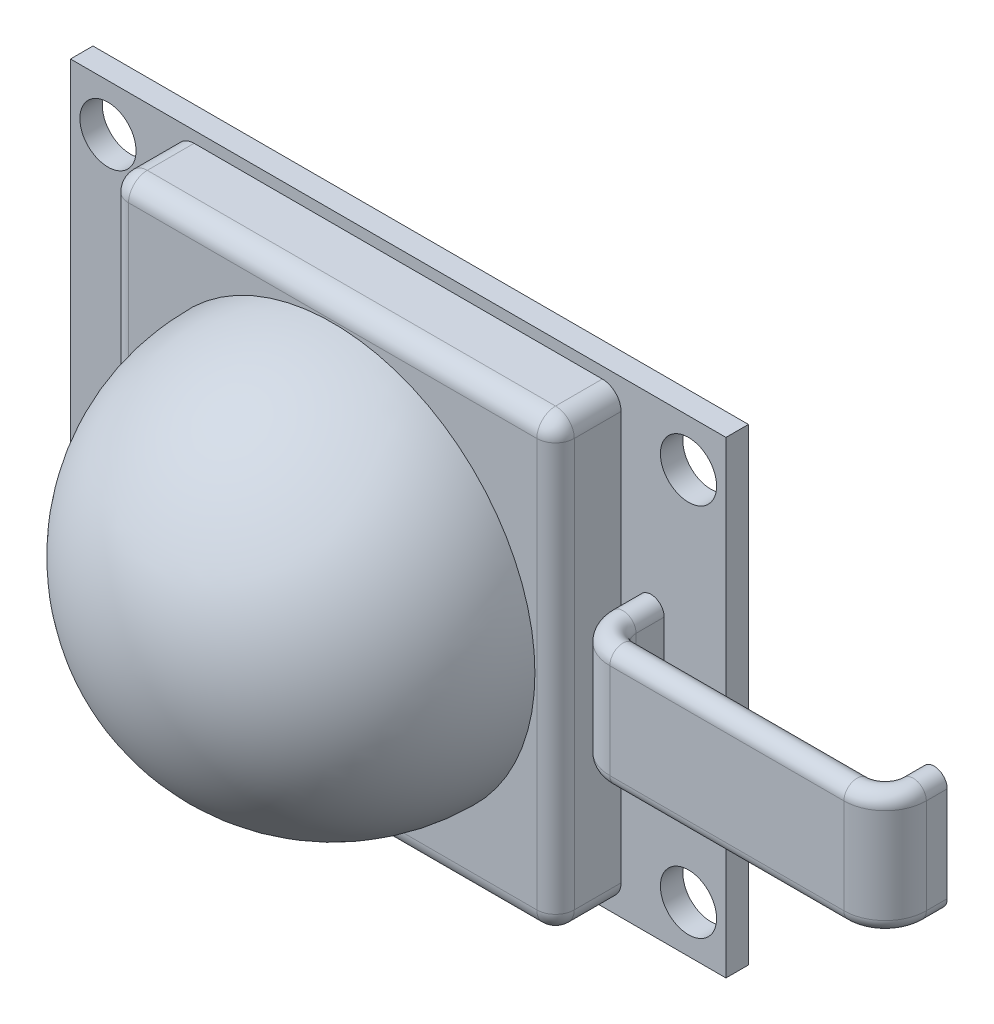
SolidWorks part; units mm, degrees
ref_plane "Plan de face" through (0, 0, 0) normal (0, 0, 1) x (1, 0, 0)
ref_plane "Plan de dessus" through (0, 0, 0) normal (0, 1, 0) x (1, 0, 0)
ref_plane "Plan de droite" through (0, 0, 0) normal (1, 0, 0) x (0, 0, -1)
sketch "Esquisse1" plane through (0, 0, 0) normal (0, 0, 1) x (1, 0, 0)
  line L0 (-5.2892, 12.5) -> (36.046, 12.5) construction
  line L1 (0, 0) -> (35, 0)
  line L2 (0, 0) -> (0, 25)
  line L3 (0, 25) -> (35, 25)
  line L4 (35, 0) -> (35, 25)
  line L5 (17.5, 30.6892) -> (17.5, 9.2498) construction
  line L6 (0, -5.0786) -> (0, 29.9463) construction
  line L7 (-2.6889, 0) -> (40.8799, 0) construction
  line L8 (2, -3.858) -> (2, 4.5267) construction
  line L9 (11.8517, 2.5) -> (1.0259, 2.5) construction
  line L10 (31, 26.8823) -> (31, 6.9907) construction
  circle A0 centre (2, 2.5) radius 1.5
  circle A1 centre (33, 2.5) radius 1.5
  circle A2 centre (33, 22.5) radius 1.5
  circle A3 centre (2, 22.5) radius 1.5
  circle A4 centre (31, 12.5) radius 0.4
  circle A5 centre (31, 15.04) radius 0.4
  circle A6 centre (31, 9.96) radius 0.4
  dimension "D5" = 4
  dimension "D1" = 12.5
  dimension "D2" = 17.5
  dimension "D3" = 2.5
  dimension "D4" = 2
extrude "Extrusion1" add sketch "Esquisse1" along normal blind 1.2
sketch "Esquisse2" plane through (0, 0, 1.2) normal (0, 0, 1) x (1, 0, 0)
  line L0 (17.5, -2.7811) -> (17.5, 36.2357) construction
  line L1 (37.037, 12.5) -> (-14.4333, 12.5) construction
  line L2 (0, 25) -> (0, 0) construction
  line L3 (0, 0) -> (35, 0) construction
  line L5 (6.6, 24.4) -> (28.4, 24.4)
  line L6 (5.6, 23.4) -> (5.6, 1.6)
  line L7 (6.6, 0.6) -> (28.4, 0.6)
  line L8 (29.4, 23.4) -> (29.4, 1.6)
  arc A0 (28.4, 24.4) -> (29.4, 23.4) centre (28.4, 23.4) cw
  arc A1 (28.4, 0.6) -> (29.4, 1.6) centre (28.4, 1.6) ccw
  arc A2 (5.6, 1.6) -> (6.6, 0.6) centre (6.6, 1.6) ccw
  arc A3 (6.6, 24.4) -> (5.6, 23.4) centre (6.6, 23.4) ccw
  dimension "D5" = 1
  dimension "D1" = 17.5
  dimension "D2" = 12.5
  dimension "D3" = 11.9
  dimension "D4" = 11.9
extrude "Extrusion2" add sketch "Esquisse2" along normal blind 3.5
fillet "Congé1" radius 1 8 edges at (5.8929, 0.8929, 4.7) (5.6, 12.5, 4.7) (5.8929, 24.1071, 4.7) (17.5, 24.4, 4.7) (29.1071, 24.1071, 4.7) (29.4, 12.5, 4.7) (29.1071, 0.8929, 4.7) (17.5, 0.6, 4.7)
ref_plane "Plan1" through (0, 12.5, 0) normal (0, 1, 0) x (-1, 0, 0)
sketch "Esquisse3" plane through (0, 12.5, 0) normal (0, 1, 0) x (-1, 0, 0)
  line L0 (-35, 1.7735) -> (-35, 23.0413) construction
  line L1 (-17.5, -1.6656) -> (-17.5, 22.2721) construction
  line L2 (-40.7969, 4.7) -> (-14.1443, 4.7) construction
  arc A0 (-17.5, 15.5) -> (-28.3, 4.7) centre (-17.5, 4.7) ccw
  dimension "D1" = 17.5
revolve "Révol.-Mince1" add sketch "Esquisse3" angle 360 about L1
ref_plane "Plan2" through (0, 12.5, 0) normal (0, 1, 0) x (-1, 0, 0)
sketch "Esquisse4" plane through (0, 0, 1.2) normal (0, 0, 1) x (1, 0, 0)
  line L0 (31, 8.0068) -> (31, 16.7197) construction
  line L1 (32.1645, 15.04) -> (29.7653, 15.04) construction
  line L2 (32.1645, 12.5) -> (30.1652, 12.5) construction
  line L3 (31.7, 15.04) -> (31.7, 9.96)
  line L4 (30.3, 15.04) -> (30.3, 9.96)
  arc A0 (31.7, 15.04) -> (30.3, 15.04) centre (31, 15.04) ccw
  arc A1 (31.7, 9.96) -> (30.3, 9.96) centre (31, 9.96) cw
ref_plane "Plan3" through (0, 12.4984, 0) normal (0, -1, 0) x (1, 0, 0)
sketch "Esquisse5" plane through (0, 12.4984, 0) normal (0, -1, 0) x (1, 0, 0)
  line L0 (31, 1.2) -> (31, 5.2669) construction
  line L1 (31.7, 1.2) -> (30.3, 1.2) construction
  line L2 (31, 1.2) -> (31, 0) construction
  line L3 (30.7841, 4.2) -> (47.5563, 4.2) construction
  line L4 (46.5004, 0.9858) -> (46.5004, 4.4514) construction
  line L5 (46.5004, 1.6) -> (46.5004, 0) construction
  line L6 (46.5004, 1.6) -> (46.5004, 0) construction
  line L7 (35, 1.2) -> (0, 1.2) construction
  line L8 (31, 1.2) -> (31, 2.7)
  line L9 (32.5, 4.2) -> (45.0004, 4.2)
  line L10 (46.5004, 2.7) -> (46.5004, 1.5854)
  arc A0 (31, 2.7) -> (32.5, 4.2) centre (32.5, 2.7) cw
  arc A1 (45.0004, 4.2) -> (46.5004, 2.7) centre (45.0004, 2.7) cw
  point P21 (31, 4.2)
  point P24 (46.5004, 4.2)
  dimension "D2" = 1.5
  dimension "D1" = 3
sweep "Balayage1" add profiles "Esquisse4" path "Esquisse5"
